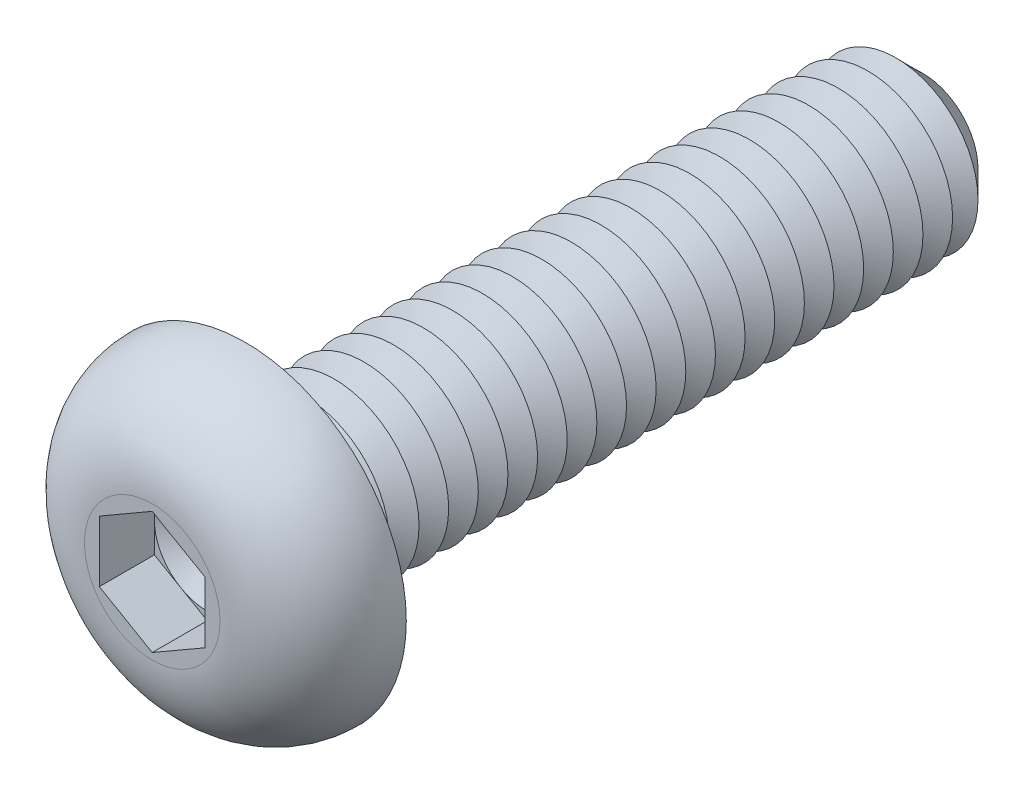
SolidWorks part; units mm, degrees
ref_plane "Front Plane" through (0, 0, 0) normal (0, 0, 1) x (1, 0, 0)
ref_plane "Top Plane" through (0, 0, 0) normal (0, 1, 0) x (1, 0, 0)
ref_plane "Right Plane" through (0, 0, 0) normal (1, 0, 0) x (0, 0, -1)
sketch "Sketch1" plane through (0, 0, 0) normal (1, 0, 0) x (0, 0, -1)
  line L0 (-47.9342, 0) -> (60.3146, 0) construction
sketch "Sketch2" plane through (0, 0, 0) normal (1, 0, 0) x (0, 0, -1)
  line L0 (0, 0) -> (-2.2, 0)
  line L1 (-47.9342, 0) -> (60.3146, 0) construction
  line L2 (-2.2, 0) -> (-2.2, 1.6)
  line L3 (0, 3.8) -> (0, 0)
  arc A0 (-2.2, 1.6) -> (0, 3.8) centre (0, 1.6) cw
  dimension "D1" = 2.2
  dimension "D2" = 2.2
  dimension "D3" = 3.8
revolve "Revolve1" add sketch "Sketch2" angle 360 about L0
sketch "Sketch3" plane through (0, 0, 2.2) normal (0, 0, 1) x (1, 0, 0)
  line L1 (0, 1.4434) -> (-1.25, 0.7217)
  line L2 (-1.25, 0.7217) -> (-1.25, -0.7217)
  line L3 (-1.25, -0.7217) -> (0, -1.4434)
  line L4 (0, -1.4434) -> (1.25, -0.7217)
  line L5 (1.25, -0.7217) -> (1.25, 0.7217)
  line L6 (1.25, 0.7217) -> (0, 1.4434)
  circle A0 centre (0, 0) radius 1.25 construction
  dimension "D1" = 2.5
extrude "Cut-Extrude1" cut sketch "Sketch3" against normal blind 1.3
sketch "Sketch4" plane through (0, 0, 0) normal (0, 0, -1) x (-1, 0, 0)
  circle A0 centre (0, 0) radius 2
  dimension "D1" = 4
extrude "Boss-Extrude1" add sketch "Sketch4" along normal blind 16
chamfer "Chamfer1" distance 0.7 angle 45 1 edges at (-2, 0, -16)
sketch "Sketch5" plane through (0, 0, 0) normal (1, 0, 0) x (0, 0, -1)
  line L0 (0.7, 2) -> (1.4, 2)
  line L1 (15.3, 2) -> (0, 2) construction
  line L2 (1.4, 2) -> (1.05, 1.3938)
  line L3 (1.05, 1.3938) -> (0.7, 2)
  line L4 (0, -3.8) -> (0, 3.8) construction
  line L5 (15.3, 2) -> (0, 2) construction
  dimension "D1" = 0.7
  dimension "D2" = 0.7
revolve "Cut-Revolve1" cut sketch "Sketch5" angle 360 about L0
pattern_linear "LPattern1" count 21 spacing 0.7 along (0, 0, -1) of "Cut-Revolve1"
fillet "Fillet2" radius 0.3 1 edges at (2, 0, 0)
sketch "Sketch6" plane through (0, 0, 0.9) normal (0, 0, 1) x (1, 0, 0)
  line L0 (0, -1.4434) -> (1.25, -0.7217) construction
  circle A0 centre (0, 0) radius 1.25
extrude "Cut-Extrude2" cut sketch "Sketch6" against normal through all draft 60
